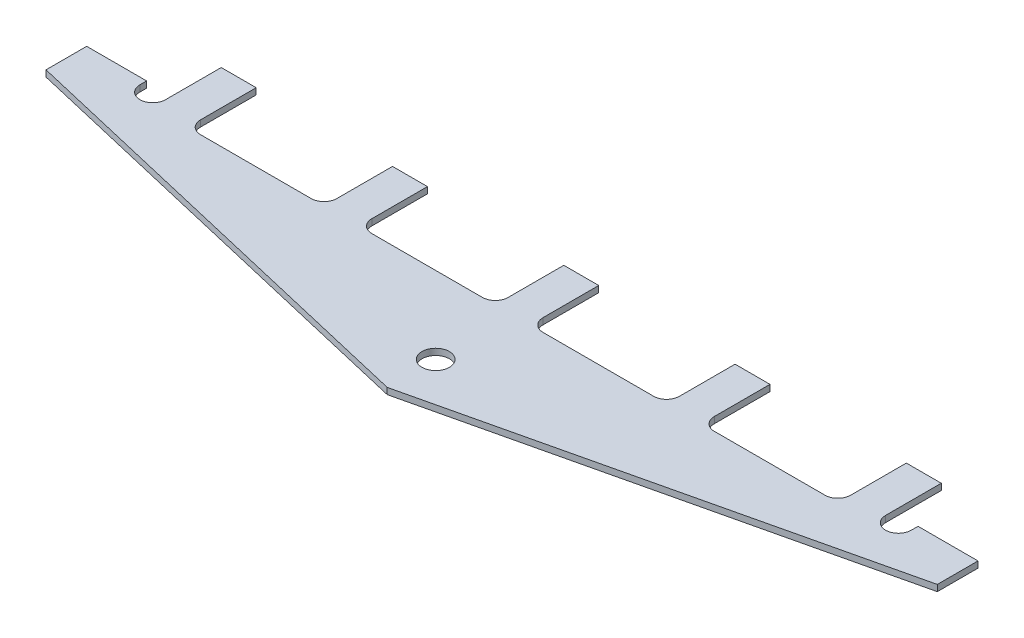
SolidWorks part; units mm, degrees
ref_plane "Front Plane" through (0, 0, 0) normal (0, 0, 1) x (1, 0, 0)
ref_plane "Top Plane" through (0, 0, 0) normal (0, 1, 0) x (1, 0, 0)
ref_plane "Right Plane" through (0, 0, 0) normal (1, 0, 0) x (0, 0, -1)
sketch "Sketch1" plane through (0, 0, 0) normal (0, 1, 0) x (1, 0, 0)
  line L0 (0, 0) -> (0, 48.766) construction
  line L1 (-3.2385, 26.9875) -> (3.2385, 26.9875)
  line L2 (3.2385, 26.9875) -> (3.2385, 16.6687)
  line L3 (5.6198, 14.2875) -> (26.1303, 14.2875)
  line L4 (28.5115, 16.6687) -> (28.5115, 26.9875)
  line L5 (28.5115, 26.9875) -> (34.9885, 26.9875)
  line L6 (34.9885, 26.9875) -> (34.9885, 16.6687)
  line L7 (60.2615, 26.9875) -> (66.7385, 26.9875)
  line L8 (37.3698, 14.2875) -> (57.8803, 14.2875)
  line L9 (66.7385, 26.9875) -> (66.7385, 16.6687)
  line L10 (60.2615, 16.6688) -> (60.2615, 26.9875)
  line L11 (71.501, 16.6687) -> (71.501, 17.9197)
  line L12 (82.6135, 17.9197) -> (82.6135, 10.3759)
  line L13 (0, -8.9789) -> (82.6135, 10.3759)
  line L14 (71.501, 17.9197) -> (82.6135, 17.9197)
  line L15 (0, -8.9789) -> (-82.6135, 10.3759)
  line L16 (-71.501, 17.9197) -> (-82.6135, 17.9197)
  line L17 (-82.6135, 17.9197) -> (-82.6135, 10.3759)
  line L18 (-71.501, 16.6687) -> (-71.501, 17.9197)
  line L19 (-60.2615, 16.6688) -> (-60.2615, 26.9875)
  line L20 (-66.7385, 26.9875) -> (-66.7385, 16.6687)
  line L21 (-37.3698, 14.2875) -> (-57.8803, 14.2875)
  line L22 (-60.2615, 26.9875) -> (-66.7385, 26.9875)
  line L23 (-34.9885, 26.9875) -> (-34.9885, 16.6687)
  line L24 (-28.5115, 26.9875) -> (-34.9885, 26.9875)
  line L25 (-28.5115, 16.6687) -> (-28.5115, 26.9875)
  line L26 (-5.6198, 14.2875) -> (-26.1303, 14.2875)
  line L27 (-3.2385, 26.9875) -> (-3.2385, 16.6687)
  circle A0 centre (0, 0) radius 2.54
  arc A1 (3.2385, 16.6687) -> (5.6198, 14.2875) centre (5.6198, 16.6687) ccw
  arc A2 (26.1303, 14.2875) -> (28.5115, 16.6687) centre (26.1302, 16.6687) ccw
  arc A3 (57.8803, 14.2875) -> (60.2615, 16.6688) centre (57.8803, 16.6688) ccw
  arc A4 (34.9885, 16.6687) -> (37.3698, 14.2875) centre (37.3698, 16.6687) ccw
  arc A5 (66.7385, 16.6687) -> (71.501, 16.6687) centre (69.1198, 16.6687) ccw
  arc A6 (-66.7385, 16.6687) -> (-71.501, 16.6687) centre (-69.1198, 16.6687) cw
  arc A7 (-34.9885, 16.6687) -> (-37.3698, 14.2875) centre (-37.3698, 16.6687) cw
  arc A8 (-57.8803, 14.2875) -> (-60.2615, 16.6688) centre (-57.8803, 16.6688) cw
  arc A9 (-26.1303, 14.2875) -> (-28.5115, 16.6687) centre (-26.1302, 16.6687) cw
  arc A10 (-3.2385, 16.6687) -> (-5.6198, 14.2875) centre (-5.6198, 16.6687) cw
  point P6 (0, 26.9875)
  point P18 (31.75, 26.9875)
  point P26 (63.5, 26.9875)
  dimension "D1" = 5.08
  dimension "D6" = 2.3813
  dimension "D8" = 2.3813
  dimension "D10" = 3.6322
  dimension "D2" = 6.477
  dimension "D3" = 31.75
  dimension "D4" = 31.75
  dimension "D5" = 12.7
  dimension "D7" = 26.9875
  dimension "D9" = 2.3813
  dimension "D11" = 165.227
  dimension "D12" = 7.5438
  dimension "D13" = 35.9664
base flange "Base-Flange1" sketch "Sketch1" thickness 1.1684 reverse thickness direction no parameters "D1"=1.524
sketch "Bend-Lines1" [suppressed] plane through (0, 0, 0) normal (0, 1, 0) x (1, 0, 0)
sketch "Bounding-Box1" [suppressed] plane through (0, 0, 0) normal (0, 1, 0) x (1, 0, 0)
sheet metal parameters "Sheet-Metal1" thickness 1.1684 parameters "D1"=1.524
flat pattern "Flat-Pattern1"
sketch "Bend-Lines2" plane through (0, 0, 0) normal (0, 1, 0) x (1, 0, 0)
sketch3d "Bounding-Box2" [suppressed]
  line L0 (88.2332, 10.3187, 0) -> (-76.9937, 10.3187, 0) construction
  line L1 (88.2332, -25.6476, 0) -> (-76.9937, -25.6476, 0) construction
  line L2 (88.2332, 10.3187, 0) -> (88.2332, -25.6476, 0) construction
  line L3 (-76.9937, 10.3187, 0) -> (-76.9937, -25.6476, 0) construction
